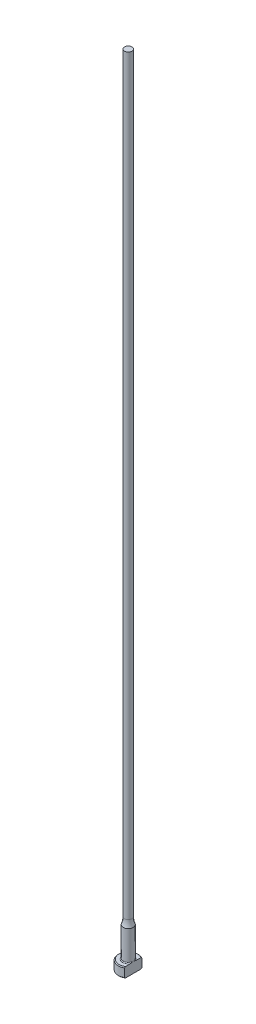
SolidWorks part; units mm, degrees
ref_plane "Front Plane" through (0, 0, 0) normal (0, 0, 1) x (1, 0, 0)
ref_plane "Top Plane" through (0, 0, 0) normal (0, 1, 0) x (1, 0, 0)
ref_plane "Right Plane" through (0, 0, 0) normal (1, 0, 0) x (0, 0, -1)
sketch "Sketch1" plane through (0, 0, 0) normal (0, 0, 1) x (1, 0, 0)
  line L0 (0, 259.9588) -> (0, -15.1925) construction
  line L1 (0, 0) -> (-3.175, 0)
  line L2 (-3.175, 0) -> (-3.175, 3.175)
  line L3 (-3.175, 3.175) -> (-1.5875, 3.175)
  line L4 (-1.19, 14.9114) -> (-1.19, 254)
  line L5 (-1.19, 254) -> (0, 254)
  line L6 (0, 254) -> (0, 0)
  line L7 (-1.5875, 3.175) -> (-1.5875, 12.7)
  arc A0 (-1.5875, 12.7) -> (-1.19, 14.9114) centre (-7.54, 14.9114) ccw
  point P13 (-1.5875, 0)
  dimension "D1" = 6.35
  dimension "L" = 254
  dimension "D2" = 3.175
  dimension "H" = 6.35
  dimension "T" = 3.175
  dimension "D" = 2.38
  dimension "S" = 12.7
revolve "Revolve1" add sketch "Sketch1" angle 360 about L0
chamfer "Chamfer1" distance 0.254 angle 45 2 edges at (0, 3.175, 3.175) (0, 0, 3.175)
fillet "Fillet1" radius 0.254 1 edges at (0, 3.175, 1.5875)
sketch "Sketch2" plane through (0, 0, 0) normal (0, 1, 0) x (1, 0, 0)
  line L0 (1.5875, -2.7496) -> (1.5875, 2.7496)
  circle A0 centre (0, 0) radius 3.175 construction
  arc A2 (1.5875, -2.7496) -> (1.5875, 2.7496) centre (0, 0) ccw
  circle A3 centre (0, 0) radius 3.175 construction
  circle A4 centre (0, 0) radius 1.5875 construction
extrude "Key Head" cut sketch "Sketch2" along normal up to next
